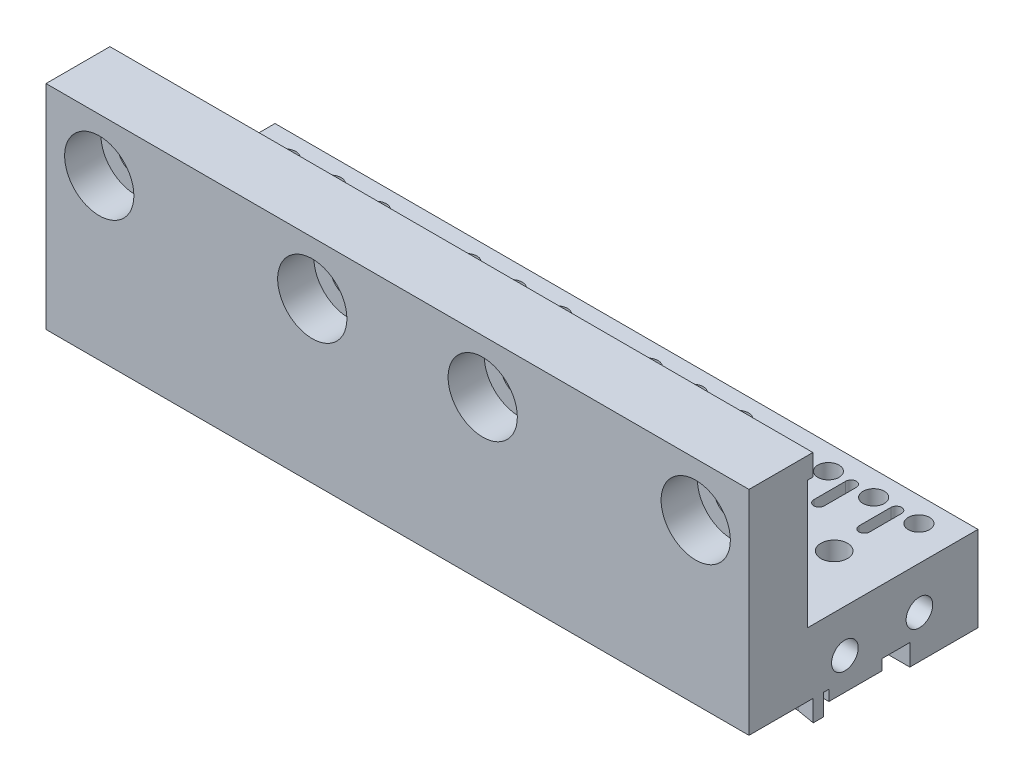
SolidWorks part; units mm, degrees
ref_plane "前视基准面" through (0, 0, 0) normal (0, 0, 1) x (1, 0, 0)
ref_plane "上视基准面" through (0, 0, 0) normal (0, 1, 0) x (1, 0, 0)
ref_plane "右视基准面" through (0, 0, 0) normal (1, 0, 0) x (0, 0, -1)
sketch "草图1" plane through (0, 0, 0) normal (0, 0, 1) x (1, 0, 0)
  line L10 (-33, 11) -> (33, 11)
  line L11 (-33, 11) -> (-33, -11)
  line L12 (-33, -11) -> (33, -11)
  line L13 (33, 11) -> (33, -11)
  line L14 (0, -11) -> (0, 11) construction
  line L15 (-33, 0) -> (33, 0) construction
  point P0 (0, 0)
  dimension "D1" = 66
  dimension "D2" = 22
extrude "凸台-拉伸1" add sketch "草图1" against normal blind 5.5
sketch "草图11" plane through (0, 0, -5.5) normal (0, 0, -1) x (-1, 0, 0)
  line L0 (-33, 11) -> (33, 11) construction
  line L1 (-33, 11) -> (33, 11)
  line L2 (-33, 11) -> (-33, 9)
  line L3 (-33, 9) -> (33, 9)
  line L4 (33, 11) -> (33, 9)
  line L5 (0, 9) -> (0, 11) construction
  line L6 (-33, 10) -> (33, 10) construction
  line L7 (33, 11) -> (33, -11) construction
  line L8 (-33, -11) -> (-33, 11) construction
  point P0 (0, 10)
  dimension "D1" = 2
extrude "凸台-拉伸5" add sketch "草图11" along normal blind 0.5
hole_wizard "M3 六角凹头螺钉的柱形沉头孔1" positions "草图12" profile "草图13" counterbore size "M3" standard "ISO"
sketch "草图12" plane through (0, 0, 0) normal (0, 0, 1) x (1, 0, 0)
  line L2 (33, 11) -> (-33, 11) construction
  line L5 (0, 0) -> (0, 18.3701) construction
  point P0 (-28, 6)
  point P2 (-8, 6)
  point P32 (8, 6)
  point P33 (28, 6)
  dimension "D1" = 20
  dimension "D3" = 5
sketch "草图13" plane through (-28, 6, 0) normal (1, 0, 0) x (0, -1, 0)
  line L0 (0, 0) -> (0, 6)
  line L1 (0, 6) -> (1.7, 6)
  line L3 (1.7, 6) -> (1.7, 3.4)
  line L4 (1.7, 3.4) -> (3.25, 3.4)
  line L5 (3.25, 3.4) -> (3.25, 0)
  line L7 (3.25, 0) -> (0, 0)
  line L11 (0, -6.35) -> (0, 107.95) construction
  dimension "通孔孔直径" = 3.4
  dimension "通孔孔深度" = 6
  dimension "柱形沉头孔直径" = 6.5
  dimension "柱形沉头孔深度" = 3.4
sketch "草图14" plane through (0, 0, -5.5) normal (0, 0, -1) x (-1, 0, 0)
  line L0 (33, 9) -> (33, -11) construction
  line L1 (-33, -11) -> (33, -11)
  line L2 (-33, -11) -> (-33, -3)
  line L3 (-33, -3) -> (33, -3)
  line L4 (33, -11) -> (33, -3)
  dimension "D1" = 8
extrude "凸台-拉伸6" add sketch "草图14" along normal blind 16
sketch "草图15" plane through (0, -11, 0) normal (0, -1, 0) x (1, 0, 0)
  line L0 (-33, -21.5) -> (-33, 0) construction
  line L1 (-29.75, -5.3) -> (-21.25, -5.3)
  line L2 (-29.75, -5.3) -> (-29.75, -12.5)
  line L3 (-29.75, -12.5) -> (-21.25, -12.5)
  line L4 (-21.25, -5.3) -> (-21.25, -12.5)
  line L5 (-29.75, -5.3) -> (-21.25, -12.5) construction
  line L6 (-29.75, -12.5) -> (-21.25, -5.3) construction
  line L7 (-33, 0) -> (33, 0) construction
  point P0 (-25.5, -8.9)
  dimension "D1" = 3.25
  dimension "D2" = 8.5
  dimension "D3" = 5.3
  dimension "D4" = 7.2
extrude "切除-拉伸1" cut sketch "草图15" against normal blind 0.52
sketch "草图16" plane through (0, -11, 0) normal (0, -1, 0) x (1, 0, 0)
  line L0 (-21.25, -5.3) -> (-29.75, -5.3) construction
  line L2 (-30.75, -4.3) -> (-20.25, -4.3)
  line L3 (-30.75, -4.3) -> (-30.75, -7.3)
  line L4 (-30.75, -7.3) -> (-20.25, -7.3)
  line L5 (-20.25, -4.3) -> (-20.25, -7.3)
  line L6 (-21.25, -12.5) -> (-21.25, -5.3) construction
  line L7 (-29.75, -5.3) -> (-29.75, -12.5) construction
  dimension "D1" = 2
  dimension "D2" = 3
  dimension "D3" = 1
  dimension "D4" = 1
extrude "切除-拉伸2" cut sketch "草图16" against normal blind 8
fillet "圆角1" radius 0.5 4 edges at (-20.25, -7, -4.3) (-20.25, -7, -7.3) (-30.75, -7, -7.3) (-30.75, -7, -4.3)
sketch "草图17" plane through (0, -10.48, 0) normal (0, -1, 0) x (1, 0, 0)
  line L0 (-25.5, -7.3) -> (-25.5, -10.8196) construction
  line L1 (-29.75, -7.3) -> (-21.25, -7.3) construction
  circle A0 centre (-23.7, -8.1) radius 0.5
  circle A2 centre (-25.5, -8.1) radius 0.5
  circle A4 centre (-27.3, -8.1) radius 0.5
  dimension "D1" = 1
  dimension "D2" = 0.8
  dimension "D3" = 1.8
extrude "切除-拉伸3" cut sketch "草图17" against normal blind 3
sketch "草图18" plane through (0, 0, -21.5) normal (0, 0, -1) x (-1, 0, 0)
  line L0 (4.1809, -5.6764) -> (13.4923, -5.6764) construction
  line L1 (4.1809, -5.0215) -> (13.4923, -5.0215)
  line L2 (4.1809, -6.3313) -> (13.4923, -6.3313)
  arc A0 (4.1809, -5.0215) -> (4.1809, -6.3313) centre (4.1809, -5.6764) ccw
  arc A1 (13.4923, -6.3313) -> (13.4923, -5.0215) centre (13.4923, -5.6764) ccw
  point P2 (8.8366, -5.6764)
extrude "切除-拉伸4" [suppressed] cut sketch "草图18" against normal blind 14
pattern_linear "阵列(线性)1" count 4 spacing 17 along (1, 0, 0) of "圆角1", "切除-拉伸3", "切除-拉伸2", "切除-拉伸1"
hole_wizard "Ø2.0 (2) 直径孔1" positions "草图19" profile "草图20" hole size "Ø2.0" standard "ISO"
sketch "草图19" plane through (0, -11, 0) normal (0, -1, 0) x (-1, 0, 0)
  line L0 (-33, 21.5) -> (33, 21.5) construction
  line L1 (-33, 21.5) -> (-33, 0) construction
  point P11 (-21.25, 19.205)
  point P14 (-25.5, 19.205)
  point P17 (-29.75, 19.2)
  point P30 (-4.25, 19.205)
  point P31 (-8.5, 19.205)
  point P32 (-12.75, 19.2)
  point P33 (12.75, 19.205)
  point P34 (8.5, 19.205)
  point P35 (4.25, 19.2)
  point P36 (29.75, 19.205)
  point P37 (25.5, 19.205)
  point P38 (21.25, 19.2)
  dimension "D1" = 2.3
  dimension "D2" = 4.25
  dimension "D3" = 4.25
  dimension "D4" = 3.25
  dimension "D5" = 4
sketch "草图20" plane through (21.25, -11, -19.205) normal (1, 0, 0) x (0, 0, -1)
  line L0 (0, 0) -> (0, 22)
  line L1 (0, 22) -> (1, 22)
  line L2 (1, 22) -> (1, 0)
  line L5 (1, 0) -> (0, 0)
  line L11 (0, -6.35) -> (0, 107.95) construction
  dimension "通孔孔直径" = 2
  dimension "通孔孔深度" = 22
sketch "草图21" plane through (0, -11, 0) normal (0, -1, 0) x (1, 0, 0)
  circle A0 centre (-29.75, -12.5) radius 0.5
  circle A1 centre (-21.25, -12.5) radius 0.5
  circle A2 centre (-12.75, -12.5) radius 0.5
  circle A3 centre (-4.25, -12.5) radius 0.5
  circle A4 centre (4.25, -12.5) radius 0.5
  circle A5 centre (12.75, -12.5) radius 0.5
  circle A6 centre (21.25, -12.5) radius 0.5
  circle A7 centre (29.75, -12.5) radius 0.5
  dimension "D1" = 1
extrude "切除-拉伸5" cut sketch "草图21" against normal up to surface (0.52 mm away)
hole_wizard "M3 螺纹孔1" positions "草图22" profile "草图24" tap size "M3" standard "ISO"
sketch "草图22" plane through (-33, 0, 0) normal (-1, 0, 0) x (0, 0, 1)
  line L0 (-21.5, -7) -> (0, -7) construction
  line L1 (-21.5, -11) -> (-21.5, -3) construction
  line L2 (0, 11) -> (0, -11) construction
  point P0 (-9, -7)
  point P16 (-16, -7)
  dimension "D1" = 12.5
  dimension "D2" = 7
sketch "草图24" plane through (-33, -7, -9) normal (0, 1, 0) x (0, 0, 1)
  line L0 (0, 0) -> (0, 35.7511)
  line L1 (0, 35.7511) -> (1.25, 35)
  line L2 (1.25, 35) -> (1.25, 0)
  line L5 (1.25, 0) -> (0, 0)
  line L10 (0, 35.7511) -> (-1.25, 35) construction
  line L11 (0, -6.35) -> (0, 107.95) construction
  dimension "螺纹孔钻头直径" = 2.5
  dimension "螺纹孔钻头深度" = 35
  dimension "导头角度" = 118
mirror "镜向1" about plane through (0, 0, 0) normal (1, 0, 0) of "M3 螺纹孔1"
sketch "草图25" plane through (0, -11, 0) normal (0, -1, 0) x (1, 0, 0)
  line L0 (33, -21.5) -> (33, 0) construction
  line L1 (-33, 0) -> (33, 0)
  line L2 (-33, 0) -> (-33, -6.7)
  line L3 (-29.75, -6.7) -> (-21.25, -6.7)
  line L4 (33, 0) -> (33, -6.7)
  line L5 (-29.75, -7.5) -> (-33, -7.5)
  line L6 (-29.75, -7.3) -> (-29.75, -12) construction
  line L7 (-33, -21.5) -> (-33, 0) construction
  line L8 (-33, -7.5) -> (-33, -6.7)
  line L9 (-29.75, -7.5) -> (-29.75, -6.7)
  line L10 (-21.25, -7.5) -> (-12.75, -7.5)
  line L11 (-21.25, -12) -> (-21.25, -7.3) construction
  line L12 (-12.75, -7.3) -> (-12.75, -12) construction
  line L13 (-4.25, -7.5) -> (33, -7.5)
  line L14 (-4.25, -12) -> (-4.25, -7.3) construction
  line L15 (33, -7.5) -> (33, -6.7)
  line L16 (-21.25, -7.5) -> (-21.25, -6.7)
  line L17 (-12.75, -7.5) -> (-12.75, -6.7)
  line L18 (-4.25, -7.5) -> (-4.25, -6.7)
  line L19 (-12.75, -6.7) -> (-4.25, -6.7)
  line L21 (-33, -12.5) -> (33, -12.5)
  line L22 (-33, -12.5) -> (-33, -15.1)
  line L23 (-33, -15.1) -> (33, -15.1)
  line L24 (33, -12.5) -> (33, -15.1)
  dimension "D1" = 6.7
  dimension "D2" = 7.5
  dimension "D3" = 6.7
  dimension "D4" = 12.5
  dimension "D5" = 2.6
extrude "切除-拉伸6" cut sketch "草图25" against normal blind 2
sketch "草图26" plane through (0, -11, 0) normal (0, -1, 0) x (1, 0, 0)
  line L1 (-4.25, -7.5) -> (-4.25, -12) construction
  line L2 (-3.75, -12.5) -> (3.75, -12.5) construction
  line L4 (-29.75, -7.5) -> (-33, -7.5) construction
  line L5 (-33, -7.5) -> (-33, -12.5) construction
  line L6 (-33, -12.5) -> (-30.25, -12.5) construction
  line L7 (-29.75, -12) -> (-29.75, -7.5) construction
  line L9 (-4.25, -7.5) -> (-4.25, -12.5)
  line L10 (-4.25, -12.5) -> (4.25, -12.5)
  line L12 (-29.75, -7.5) -> (-33, -7.5)
  line L13 (-33, -7.5) -> (-33, -12.5)
  line L14 (-33, -12.5) -> (-29.75, -12.5)
  line L15 (-29.75, -12.5) -> (-29.75, -7.5)
  line L16 (33, -12.5) -> (-33, -12.5) construction
  line L17 (-4.25, -7.5) -> (4.25, -7.5)
  line L18 (4.25, -7.5) -> (4.25, -12.5)
  line L20 (-12.75, -7.5) -> (-21.25, -7.5)
  line L21 (-21.25, -7.5) -> (-21.25, -12)
  line L22 (-20.75, -12.5) -> (-13.25, -12.5)
  line L23 (-12.75, -12) -> (-12.75, -7.5)
  line L24 (-12.75, -7.5) -> (-21.25, -7.5)
  line L25 (-21.25, -7.5) -> (-21.25, -12.5)
  line L26 (-21.25, -12.5) -> (-12.75, -12.5)
  line L27 (-12.75, -12.5) -> (-12.75, -7.5)
  line L28 (12.75, -7.5) -> (21.25, -7.5)
  line L29 (12.75, -7.5) -> (12.75, -12.5)
  line L30 (12.75, -12.5) -> (21.25, -12.5)
  line L31 (21.25, -7.5) -> (21.25, -12.5)
  line L32 (29.75, -7.5) -> (33, -7.5)
  line L33 (29.75, -7.5) -> (29.75, -12.5)
  line L34 (29.75, -12.5) -> (33, -12.5)
  line L35 (33, -7.5) -> (33, -12.5)
  arc A6 (-20.75, -12.5) -> (-21.25, -12) centre (-21.25, -12.5) ccw
  arc A7 (-12.75, -12) -> (-13.25, -12.5) centre (-12.75, -12.5) ccw
  dimension "D1" = 0
extrude "切除-拉伸7" cut sketch "草图26" against normal blind 1
sketch "草图27" plane through (0, -9, 0) normal (0, -1, 0) x (1, 0, 0)
  line L0 (-33, 0) -> (-33, -7.5) construction
  line L1 (-31.25, -6.33) -> (-30.75, -6.33)
  line L2 (-33, -6.33) -> (-33, -6.68)
  line L3 (-31.25, -6.68) -> (-30.75, -6.68)
  line L4 (-30.75, -6.33) -> (-30.75, -6.68)
  line L5 (33, 0) -> (-33, 0) construction
  line L6 (-30.75, -4.8) -> (-30.75, -6.8) construction
  line L7 (-20.25, -6.8) -> (-20.25, -4.8) construction
  line L8 (-20.25, -6.33) -> (-19.25, -6.33)
  line L9 (-20.25, -6.33) -> (-20.25, -6.68)
  line L10 (-20.25, -6.68) -> (-19.25, -6.68)
  line L11 (-13.75, -6.33) -> (-13.75, -6.68)
  line L12 (-13.75, -4.8) -> (-13.75, -6.8) construction
  line L13 (33, -6.505) -> (30.75, -6.505) construction
  line L18 (-21.25, -12.5) -> (-12.75, -12.5) construction
  line L19 (-31.25, -6.33) -> (-33, -6.03)
  line L20 (-33, -6.505) -> (-30.75, -6.505) construction
  line L21 (-31.25, -6.68) -> (-33, -6.98)
  line L22 (-33, -6.03) -> (-33, -6.33)
  line L23 (-33, -6.98) -> (-33, -6.68)
  line L24 (-19.25, -6.33) -> (-17, -5.83)
  line L25 (-17, -5.83) -> (-14.75, -6.33)
  line L26 (-17, 0) -> (-17, -12.5) construction
  line L27 (-17, -7.18) -> (-14.75, -6.68)
  line L28 (-19.25, -6.68) -> (-17, -7.18)
  line L29 (-3.25, -6.33) -> (-2.25, -6.33)
  line L38 (-14.75, -6.68) -> (-13.75, -6.68)
  line L39 (-14.75, -6.33) -> (-13.75, -6.33)
  line L40 (-3.25, -6.33) -> (-3.25, -6.68)
  line L41 (-3.25, -6.68) -> (-2.25, -6.68)
  line L42 (3.25, -6.33) -> (3.25, -6.68)
  line L43 (-2.25, -6.33) -> (0, -5.83)
  line L44 (0, -5.83) -> (2.25, -6.33)
  line L45 (0, -7.18) -> (2.25, -6.68)
  line L46 (-2.25, -6.68) -> (0, -7.18)
  line L47 (2.25, -6.68) -> (3.25, -6.68)
  line L48 (2.25, -6.33) -> (3.25, -6.33)
  line L49 (13.75, -6.33) -> (14.75, -6.33)
  line L50 (13.75, -6.33) -> (13.75, -6.68)
  line L51 (13.75, -6.68) -> (14.75, -6.68)
  line L52 (20.25, -6.33) -> (20.25, -6.68)
  line L53 (14.75, -6.33) -> (17, -5.83)
  line L54 (17, -5.83) -> (19.25, -6.33)
  line L55 (17, -7.18) -> (19.25, -6.68)
  line L56 (14.75, -6.68) -> (17, -7.18)
  line L57 (19.25, -6.68) -> (20.25, -6.68)
  line L58 (19.25, -6.33) -> (20.25, -6.33)
  line L69 (30.75, -6.33) -> (31.75, -6.33)
  line L70 (30.75, -6.33) -> (30.75, -6.68)
  line L71 (30.75, -6.68) -> (31.75, -6.68)
  line L72 (37.25, -6.33) -> (37.25, -6.68)
  line L73 (31.75, -6.33) -> (34, -5.83)
  line L74 (34, -5.83) -> (36.25, -6.33)
  line L75 (34, -7.18) -> (36.25, -6.68)
  line L76 (31.75, -6.68) -> (34, -7.18)
  line L77 (36.25, -6.68) -> (37.25, -6.68)
  line L78 (36.25, -6.33) -> (37.25, -6.33)
  line L79 (0, 0) -> (0, -11.0865) construction
  line L80 (33, -6.98) -> (33, -6.68)
  line L81 (33, -6.03) -> (33, -6.33)
  line L82 (31.25, -6.68) -> (33, -6.98)
  line L83 (31.25, -6.33) -> (33, -6.03)
  line L84 (30.75, -6.33) -> (30.75, -6.68)
  line L85 (31.25, -6.68) -> (30.75, -6.68)
  line L86 (33, -6.33) -> (33, -6.68)
  line L87 (31.25, -6.33) -> (30.75, -6.33)
  dimension "D1" = 6.68
  dimension "D2" = 0.35
  dimension "D3" = 0.5
  dimension "D4" = 0.3
  dimension "D5" = 1
  dimension "D6" = 1
  dimension "D7" = 0.5
  dimension "D8" = 4
extrude "凸台-拉伸7" add sketch "草图27" along normal up to surface (2 mm away)
sketch "草图28" plane through (0, -9, 0) normal (0, -1, 0) x (1, 0, 0)
  line L0 (-33, 0) -> (-32, 0)
  line L1 (33, 0) -> (-33, 0) construction
  line L2 (-32, 0) -> (-32, -6.2014)
  line L3 (-31.25, -6.33) -> (-33, -6.03) construction
  line L4 (-32, -6.2014) -> (-33, -6.03)
  line L5 (-33, -6.03) -> (-33, 0)
  line L6 (-17, -5.83) -> (-17, 0) construction
  line L17 (-14.75, -6.33) -> (-17, -5.83) construction
  line L18 (-18, 0) -> (-16, 0)
  line L19 (-18, 0) -> (-18, -6.0522)
  line L20 (-18, -6.0522) -> (-16, -6.0522)
  line L21 (-16, 0) -> (-16, -6.0522)
  line L22 (-18, 0) -> (-16, -6.0522) construction
  line L23 (-18, -6.0522) -> (-16, 0) construction
  line L24 (0, 0) -> (0, -11.3663) construction
  line L25 (-1, 0) -> (1, 0)
  line L26 (-1, 0) -> (-1, -6.0522)
  line L27 (-1, -6.0522) -> (1, -6.0522)
  line L28 (1, 0) -> (1, -6.0522)
  line L29 (0, -5.83) -> (0, 0) construction
  line L30 (-1, 0) -> (1, -6.0522) construction
  line L31 (-1, -6.0522) -> (1, 0) construction
  line L32 (16, 0) -> (18, 0)
  line L33 (16, 0) -> (16, -6.0522)
  line L34 (16, -6.0522) -> (18, -6.0522)
  line L35 (18, 0) -> (18, -6.0522)
  line L36 (17, -5.83) -> (17, 0) construction
  line L37 (16, 0) -> (18, -6.0522) construction
  line L38 (16, -6.0522) -> (18, 0) construction
  line L39 (33, -6.03) -> (33, 0)
  line L40 (32, -6.2014) -> (33, -6.03)
  line L41 (32, 0) -> (32, -6.2014)
  line L42 (33, 0) -> (32, 0)
  point P13 (-17, -3.0261)
  point P28 (0, -3.0261)
  point P35 (17, -3.0261)
  dimension "D1" = 1
  dimension "D2" = 2
  dimension "D3" = 3
extrude "凸台-拉伸8" [suppressed] add sketch "草图28" along normal up to surface (2 mm away)
fillet "圆角2" radius 0.5 4 edges at (-4.25, -9.5, -7.5) (-12.75, -9.5, -7.5) (-21.25, -9.5, -7.5) (-29.75, -9.5, -7.5)
fillet "圆角3" radius 1 22 edges at (-14.75, -10, -6.33) (-19.25, -10, -6.33) (-17, -10, -5.83) (-14.75, -10, -6.68) (-17, -10, -7.18) (-19.25, -10, -6.68) (-31.25, -10, -6.68) (-31.25, -10, -6.33) (31.25, -10, -6.33) (31.25, -10, -6.68) (14.75, -10, -6.68) (19.25, -10, -6.68) (17, -10, -7.18) (19.25, -10, -6.33) (14.75, -10, -6.33) (17, -10, -5.83) (-2.25, -10, -6.33) (0, -10, -5.83) (2.25, -10, -6.33) (2.25, -10, -6.68) (-2.25, -10, -6.68) (0, -10, -7.18)
hole_wizard "Ø1.0 (1) 直径孔2" positions "草图29" profile "草图30" hole size "Ø1.0" standard "GB"
sketch "草图29" plane through (0, -11, 0) normal (0, -1, 0) x (-1, 0, 0)
  line L1 (-29.75, 19.2) -> (-25.5, 19.205) construction
  line L4 (-25.5, 19.205) -> (-21.25, 19.205) construction
  point P4 (-23.375, 19.205)
  point P6 (-27.625, 19.2025)
  point P47 (-6.375, 19.205)
  point P48 (-10.625, 19.2025)
  point P49 (10.625, 19.205)
  point P50 (6.375, 19.2025)
  point P51 (27.625, 19.205)
  point P52 (23.375, 19.2025)
  dimension "D1" = 4
sketch "草图30" plane through (23.375, -11, -19.205) normal (1, 0, 0) x (0, 0, -1)
  line L0 (0, 0) -> (0, 22)
  line L1 (0, 22) -> (0.5, 22)
  line L2 (0.5, 22) -> (0.5, 0)
  line L5 (0.5, 0) -> (0, 0)
  line L11 (0, -6.35) -> (0, 107.95) construction
  dimension "通孔孔直径" = 1
  dimension "通孔孔深度" = 22
sketch "草图31" plane through (0, -3, 0) normal (0, 1, 0) x (1, 0, 0)
  line L0 (6.375, 19.205) -> (6.375, 16.205) construction
  line L3 (6.875, 19.205) -> (6.875, 16.205)
  line L6 (23.375, 19.205) -> (23.375, 16.205) construction
  line L7 (23.875, 19.205) -> (23.875, 16.205)
  line L8 (22.875, 19.205) -> (22.875, 16.205)
  line L9 (27.625, 19.2025) -> (27.625, 16.2025) construction
  line L10 (28.125, 19.2025) -> (28.125, 16.2025)
  line L11 (27.125, 19.2025) -> (27.125, 16.2025)
  line L12 (5.875, 19.205) -> (5.875, 16.205)
  line L13 (10.625, 19.2025) -> (10.625, 16.2025) construction
  line L14 (11.125, 19.2025) -> (11.125, 16.2025)
  line L15 (10.125, 19.2025) -> (10.125, 16.2025)
  line L16 (-10.625, 19.205) -> (-10.625, 16.205) construction
  line L17 (-10.125, 19.205) -> (-10.125, 16.205)
  line L18 (-11.125, 19.205) -> (-11.125, 16.205)
  line L19 (-6.375, 19.2025) -> (-6.375, 16.2025) construction
  line L20 (-5.875, 19.2025) -> (-5.875, 16.2025)
  line L21 (-6.875, 19.2025) -> (-6.875, 16.2025)
  line L22 (-27.625, 19.205) -> (-27.625, 16.205) construction
  line L23 (-27.125, 19.205) -> (-27.125, 16.205)
  line L24 (-28.125, 19.205) -> (-28.125, 16.205)
  line L25 (-23.375, 19.2025) -> (-23.375, 16.2025) construction
  line L26 (-22.875, 19.2025) -> (-22.875, 16.2025)
  line L27 (-23.875, 19.2025) -> (-23.875, 16.2025)
  arc A4 (23.875, 19.205) -> (22.875, 19.205) centre (23.375, 19.205) ccw
  arc A5 (22.875, 16.205) -> (23.875, 16.205) centre (23.375, 16.205) ccw
  arc A6 (28.125, 19.2025) -> (27.125, 19.2025) centre (27.625, 19.2025) ccw
  arc A7 (27.125, 16.2025) -> (28.125, 16.2025) centre (27.625, 16.2025) ccw
  arc A8 (6.875, 19.205) -> (5.875, 19.205) centre (6.375, 19.205) ccw
  arc A9 (5.875, 16.205) -> (6.875, 16.205) centre (6.375, 16.205) ccw
  arc A10 (11.125, 19.2025) -> (10.125, 19.2025) centre (10.625, 19.2025) ccw
  arc A11 (10.125, 16.2025) -> (11.125, 16.2025) centre (10.625, 16.2025) ccw
  arc A12 (-10.125, 19.205) -> (-11.125, 19.205) centre (-10.625, 19.205) ccw
  arc A13 (-11.125, 16.205) -> (-10.125, 16.205) centre (-10.625, 16.205) ccw
  arc A14 (-5.875, 19.2025) -> (-6.875, 19.2025) centre (-6.375, 19.2025) ccw
  arc A15 (-6.875, 16.2025) -> (-5.875, 16.2025) centre (-6.375, 16.2025) ccw
  arc A16 (-27.125, 19.205) -> (-28.125, 19.205) centre (-27.625, 19.205) ccw
  arc A17 (-28.125, 16.205) -> (-27.125, 16.205) centre (-27.625, 16.205) ccw
  arc A18 (-22.875, 19.2025) -> (-23.875, 19.2025) centre (-23.375, 19.2025) ccw
  arc A19 (-23.875, 16.2025) -> (-22.875, 16.2025) centre (-23.375, 16.2025) ccw
  point P0 (6.375, 17.705)
  point P9 (10.625, 17.7025)
  point P16 (23.375, 17.705)
  point P24 (27.625, 17.7025)
  point P33 (-10.625, 17.705)
  point P40 (-6.375, 17.7025)
  point P47 (-27.625, 17.705)
  point P54 (-23.375, 17.7025)
  dimension "D1" = 0.5
  dimension "D2" = 3
  dimension "D3" = 4
extrude "切除-拉伸8" cut sketch "草图31" against normal blind 1
hole_wizard "M3 螺纹孔2" positions "草图32" profile "草图33" tap size "M3" standard "GB"
sketch "草图32" plane through (0, -3, 0) normal (0, 1, 0) x (1, 0, 0)
  line L0 (-33, 21.5) -> (33, 21.5) construction
  line L1 (-33, 21.5) -> (-33, 5.5) construction
  line L2 (33, 21.5) -> (33, 5.5) construction
  line L3 (0, 0) -> (0, 21.5) construction
  point P2 (-28, 13)
  point P4 (0, 13)
  point P8 (28, 13)
  dimension "D5" = 8.5
  dimension "D6" = 5
  dimension "D7" = 5
sketch "草图33" plane through (-28, -3, -13) normal (1, 0, 0) x (0, 0, 1)
  line L0 (0, 0) -> (0, 6.2511)
  line L1 (0, 6.2511) -> (1.25, 5.5)
  line L2 (1.25, 5.5) -> (1.25, 0)
  line L5 (1.25, 0) -> (0, 0)
  line L10 (0, 6.2511) -> (-1.25, 5.5) construction
  line L11 (0, -6.35) -> (0, 107.95) construction
  dimension "螺纹孔钻头直径" = 2.5
  dimension "螺纹孔钻头深度" = 5.5
  dimension "导头角度" = 118
hole_wizard "Ø1.0 (1) 直径孔1" positions "草图34" profile "草图35" hole size "Ø1.0" standard "GB"
sketch "草图34" plane through (0, -4, 0) normal (0, 1, 0) x (1, 0, 0)
  point P0 (-27.625, 16.205)
  point P3 (-23.375, 16.2025)
  point P6 (-10.625, 16.205)
  point P9 (-6.375, 16.2025)
  point P12 (6.375, 16.205)
  point P15 (10.625, 16.2025)
  point P18 (23.375, 16.205)
  point P21 (27.625, 16.2025)
sketch "草图35" plane through (-27.625, -4, -16.205) normal (1, 0, 0) x (0, 0, 1)
  line L0 (0, 0) -> (0, 5.8004)
  line L1 (0, 5.8004) -> (0.5, 5.5)
  line L2 (0.5, 5.5) -> (0.5, 0)
  line L5 (0.5, 0) -> (0, 0)
  line L10 (0, 5.8004) -> (-0.5, 5.5) construction
  line L11 (0, -6.35) -> (0, 107.95) construction
  dimension "孔直径" = 1
  dimension "孔深度" = 5.5
  dimension "导头角度" = 118
